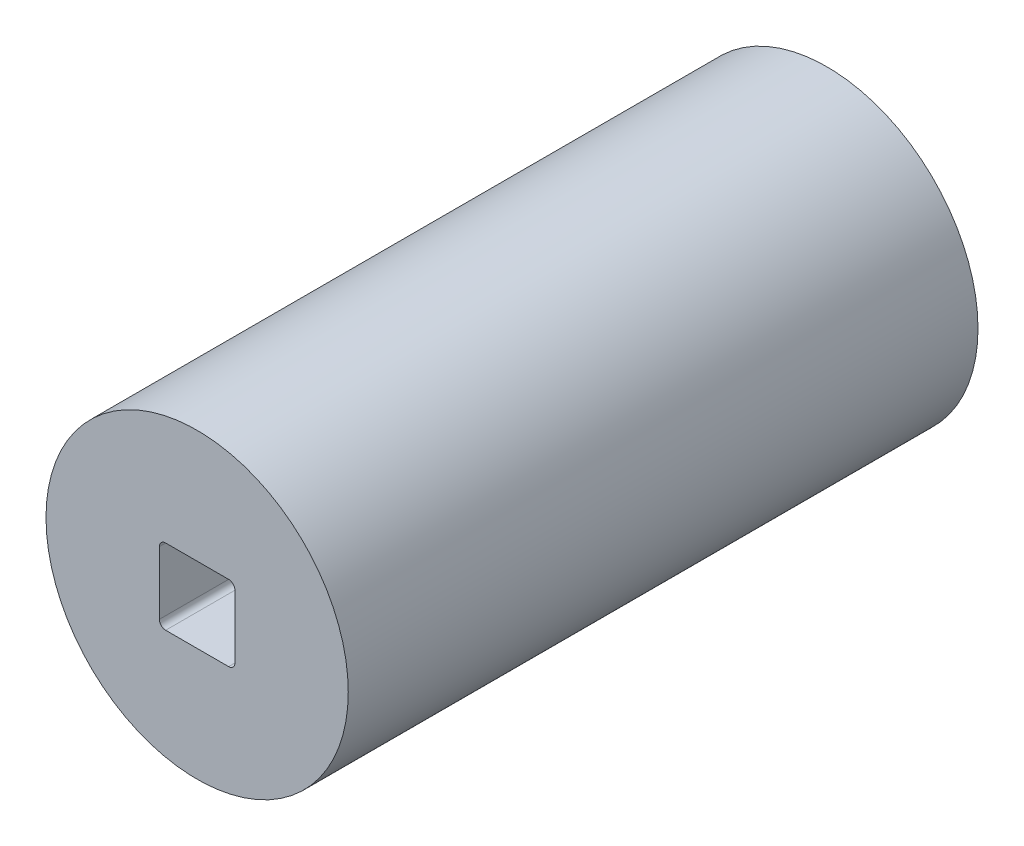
SolidWorks part; units mm, degrees
ref_plane "Front Plane" through (0, 0, 0) normal (1, 0, 0) x (0, 1, 0)
ref_plane "Top Plane" through (0, 0, 0) normal (0, 0, 1) x (0, 1, 0)
ref_plane "Right Plane" through (0, 0, 0) normal (0, 1, 0) x (-1, 0, 0)
sketch "Sketch1" plane through (0, 0, 0) normal (0, 0, 1) x (0, 1, 0)
  circle A0 centre (0, 0) radius 304.8
  dimension "D1" = 609.6
extrude "Boss-Extrude1" add sketch "Sketch1" against normal blind 1270
sketch "6in Beam Hex"
sketch_block_instance "Blk 6in Hex-1"
sketch_block "Blk 6in Hex" parameters "D1"=152.4, "D2"=152.4
sketch "Sketch3" plane through (0, 0, 0) normal (0, 0, 1) x (0, 1, 0)
  point P0 (0, 0)
  line B0 (-63.5, -76.2) -> (63.5, -76.2)
  line B1 (-76.2, -63.5) -> (-76.2, 63.5)
  line B2 (63.5, 76.2) -> (-63.5, 76.2)
  line B3 (76.2, 63.5) -> (76.2, -63.5)
  line B4 (-63.5, 63.5) -> (63.5, -63.5) construction
  line B5 (69.85, 63.5) -> (69.85, -63.5) construction
  line B6 (-63.5, -69.85) -> (63.5, -69.85) construction
  line B7 (-69.85, -63.5) -> (-69.85, 63.5) construction
  arc B8 (76.2, 63.5) -> (63.5, 76.2) centre (63.5, 63.5) ccw
  arc B9 (63.5, -76.2) -> (76.2, -63.5) centre (63.5, -63.5) ccw
  arc B10 (-76.2, -63.5) -> (-63.5, -76.2) centre (-63.5, -63.5) ccw
  arc B11 (-63.5, 76.2) -> (-76.2, 63.5) centre (-63.5, 63.5) ccw
sketch_block_instance "6in 0.25in beamOuter-1"
sketch_block "6in 0.25in beamOuter" parameters "D1"=12.7, "D2"=152.4, "D3"=152.4
extrude "Cut-Extrude1" cut sketch "Sketch3" against normal blind 1228.725
ref_plane "Plane1" through (0, 0, -1228.725) normal (0, 0, 1) x (0, 1, 0)
sketch "Sketch4" plane through (0, 0, -1228.725) normal (0, 0, 1) x (0, -1, 0)
  line B0 (131.9823, -228.6) -> (263.9645, 0)
  line B1 (263.9645, 0) -> (131.9823, 228.6)
  line B2 (131.9823, 228.6) -> (-131.9823, 228.6)
  line B3 (-131.9823, 228.6) -> (-263.9645, 0)
  line B4 (-263.9645, 0) -> (-131.9823, -228.6)
  line B5 (-131.9823, -228.6) -> (131.9823, -228.6)
  circle B6 centre (0, 0) radius 228.6 construction
sketch_block_instance "Hex Plate 6in-1"
sketch_block "Hex Plate 6in"
extrude "Cut-Extrude2" cut sketch "Sketch4" along normal blind 19.05
